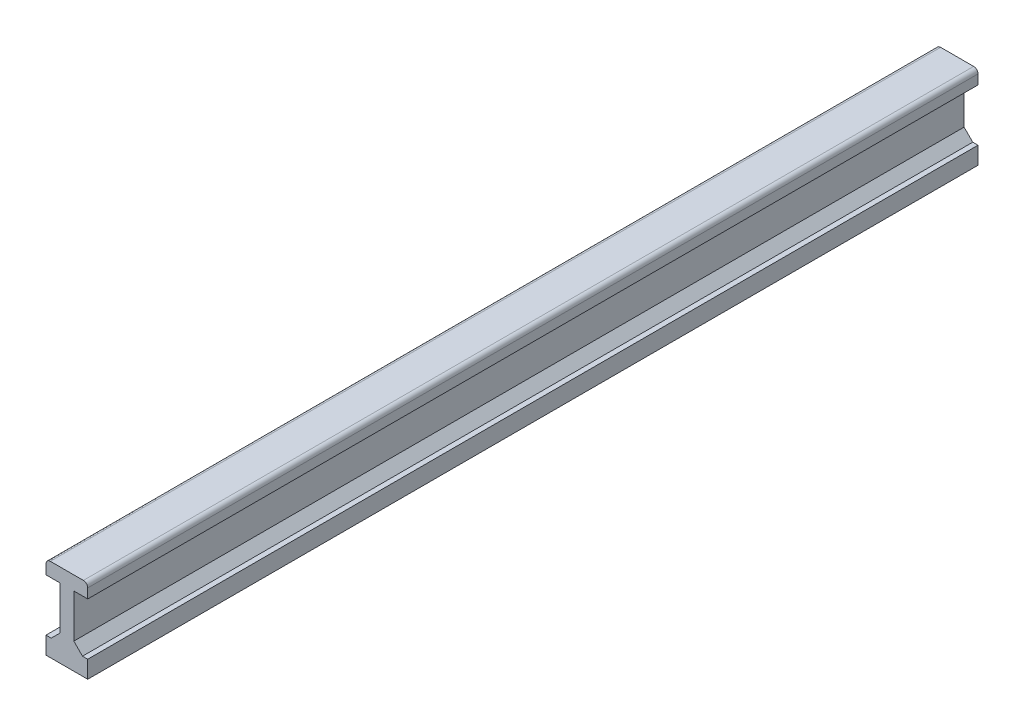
SolidWorks part; units mm, degrees
ref_plane "Front Plane" through (0, 0, 0) normal (0, 0, 1) x (1, 0, 0)
ref_plane "Top Plane" through (0, 0, 0) normal (0, 1, 0) x (1, 0, 0)
ref_plane "Right Plane" through (0, 0, 0) normal (1, 0, 0) x (0, 0, -1)
sketch "Sketch1" plane through (0, 0, 0) normal (0, 0, 1) x (1, 0, 0)
  line L0 (0, 0) -> (711.2, 0) construction
  line L1 (0, 0) -> (-711.2, 0) construction
  line L2 (-711.2, 0) -> (-711.2, 31.75) construction
  line L3 (-711.2, 152.4) -> (-787.4, 152.4) construction
  line L4 (-787.4, 152.4) -> (-787.4, 127) construction
  line L5 (-787.4, 0) -> (-711.2, 0) construction
  line L6 (711.2, 0) -> (711.2, 31.75)
  line L7 (711.2, 152.4) -> (787.4, 152.4)
  line L8 (787.4, 152.4) -> (787.4, 127)
  line L9 (787.4, 0) -> (711.2, 0)
  line L10 (-711.2, 127) -> (-736.6, 127) construction
  line L11 (-736.6, 127) -> (-736.6, 31.75) construction
  line L12 (-736.6, 31.75) -> (-711.2, 31.75) construction
  line L13 (-787.4, 127) -> (-762, 127) construction
  line L14 (-762, 127) -> (-762, 31.75) construction
  line L15 (-762, 31.75) -> (-787.4, 31.75) construction
  line L16 (711.2, 127) -> (736.6, 127)
  line L17 (736.6, 127) -> (736.6, 31.75)
  line L18 (736.6, 31.75) -> (711.2, 31.75)
  line L19 (787.4, 127) -> (762, 127)
  line L20 (762, 127) -> (762, 31.75)
  line L21 (762, 31.75) -> (787.4, 31.75)
  line L22 (-787.4, 31.75) -> (-787.4, 0) construction
  line L23 (-711.2, 127) -> (-711.2, 152.4) construction
  line L24 (787.4, 31.75) -> (787.4, 0)
  line L25 (711.2, 127) -> (711.2, 152.4)
  line L26 (749.3, 0) -> (749.3, 152.4) construction
  line L27 (-749.3, 0) -> (-749.3, 152.4) construction
  dimension "D1" = 1422.4
  dimension "D2" = 152.4
  dimension "D3" = 76.2
  dimension "D4" = 25.4
  dimension "D5" = 31.75
  dimension "D6" = 25.4
  dimension "D7" = 1574.8
extrude "Boss-Extrude1" [suppressed] add sketch "Sketch1" along normal mid plane 1828.8
sketch "Sketch2" plane through (0, 0, 0) normal (0, 0, 1) x (1, 0, 0)
  line L0 (-736.6, 127) -> (-736.6, 31.75) construction
  line L1 (-711.2, 127) -> (-736.6, 127) construction
  line L2 (-711.2, 127) -> (-711.2, 152.4) construction
  line L3 (-711.2, 152.4) -> (-787.4, 152.4) construction
  line L4 (-787.4, 152.4) -> (-787.4, 127) construction
  line L5 (-787.4, 127) -> (-762, 127) construction
  line L6 (-762, 127) -> (-762, 31.75) construction
  line L7 (-762, 31.75) -> (-787.4, 31.75) construction
  line L8 (-787.4, 31.75) -> (-787.4, 0) construction
  line L9 (-787.4, 0) -> (-711.2, 0) construction
  line L10 (-711.2, 0) -> (-711.2, 31.75) construction
  line L11 (-736.6, 31.75) -> (-711.2, 31.75) construction
  line L12 (-736.6, 127) -> (-736.6, 31.75)
  line L13 (-711.2, 127) -> (-736.6, 127)
  line L14 (-711.2, 127) -> (-711.2, 152.4)
  line L15 (-711.2, 152.4) -> (-787.4, 152.4)
  line L16 (-787.4, 152.4) -> (-787.4, 127)
  line L17 (-787.4, 127) -> (-762, 127)
  line L18 (-762, 127) -> (-762, 31.75)
  line L19 (-762, 31.75) -> (-787.4, 31.75)
  line L20 (-787.4, 31.75) -> (-787.4, 0)
  line L21 (-787.4, 0) -> (-711.2, 0)
  line L22 (-711.2, 0) -> (-711.2, 31.75)
  line L23 (-736.6, 31.75) -> (-711.2, 31.75)
extrude "Boss-Extrude2" add sketch "Sketch2" along normal mid plane 1625.6 separate body
fillet "Fillet1" radius 7.9248 2 edges at (-711.2, 152.4, 0) (-787.4, 152.4, 0)
fillet "Fillet2" [suppressed] radius 7.9248
chamfer "Chamfer1" distance 15.875 angle 45 2 edges at (-762, 31.75, 0) (-736.6, 31.75, 0)
chamfer "Chamfer2" [suppressed] distance 15.875 angle 45
ref_plane "Plane1" through (749.3, 0, 0) normal (1, 0, 0) x (0, 0, -1)
ref_plane "Pl-rail_center_2" through (-749.3, 0, 0) normal (1, 0, 0) x (0, 0, -1)
ref_plane "Pl-rail_center" through (749.3, 0, 0) normal (1, 0, 0) x (0, 0, -1)
